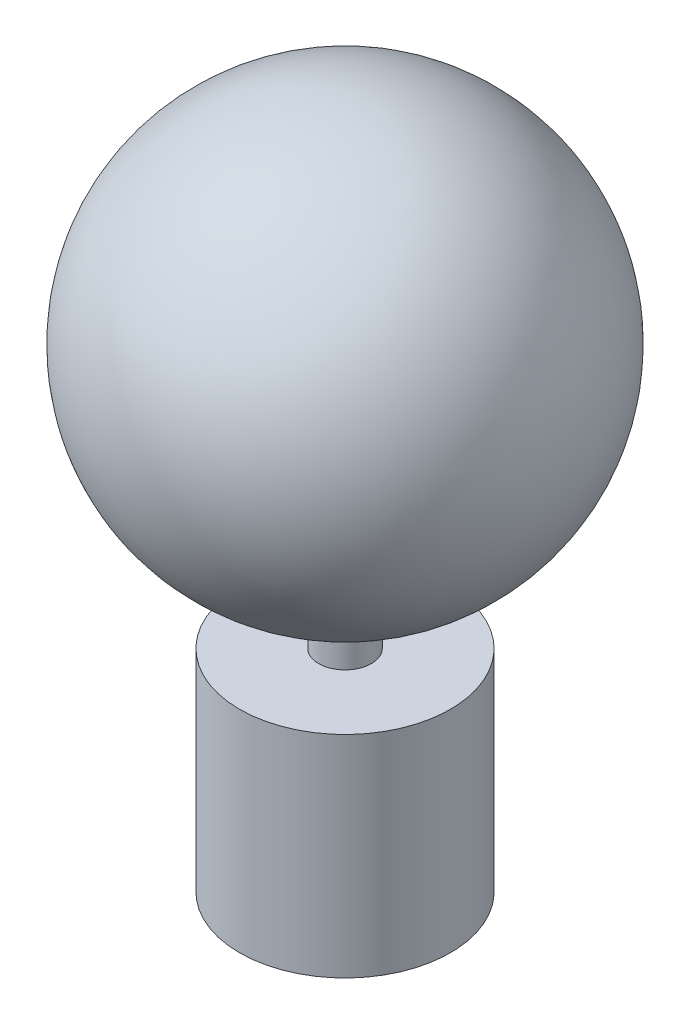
SolidWorks part; units mm, degrees
ref_plane "Front Plane" through (0, 0, 0) normal (0, 0, 1) x (1, 0, 0)
ref_plane "Top Plane" through (0, 0, 0) normal (0, 1, 0) x (1, 0, 0)
ref_plane "Right Plane" through (0, 0, 0) normal (1, 0, 0) x (0, 0, -1)
sketch "Sketch1" plane through (0, 0, 0) normal (0, 1, 0) x (1, 0, 0)
  circle A0 centre (0, 0) radius 12.7
  dimension "D1" = 25.4
extrude "Boss-Extrude1" add sketch "Sketch1" against normal blind 25.4
sketch "Sketch2" plane through (0, 0, 0) normal (0, 1, 0) x (1, 0, 0)
  circle A0 centre (0, 0) radius 3.175
  dimension "D1" = 6.35
extrude "Boss-Extrude2" add sketch "Sketch2" along normal blind 6.35
ref_plane "Plane1" through (0, 31.75, 0) normal (0, 1, 0) x (1, 0, 0)
sketch "Sketch3" plane through (0, 31.75, 0) normal (0, 1, 0) x (1, 0, 0)
  line L0 (0, 25.4) -> (0, -25.4) construction
  line L1 (0, 25.4) -> (0, -25.4)
  arc A0 (0, -25.4) -> (0, 25.4) centre (0, 0) ccw
  dimension "D1" = 50.8
revolve "Revolve4" add sketch "Sketch3" angle 360 about L0
